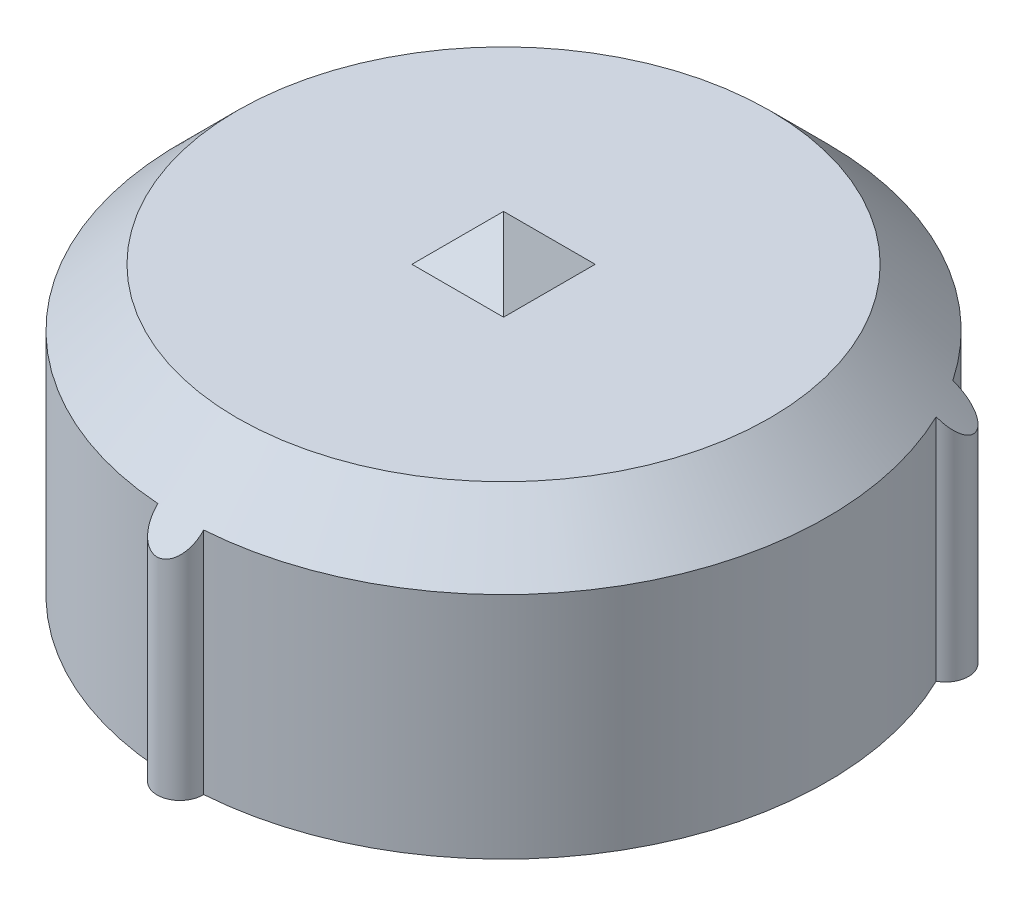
SolidWorks part; units mm, degrees
ref_plane "Front Plane" through (0, 0, 0) normal (0, 0, 1) x (1, 0, 0)
ref_plane "Top Plane" through (0, 0, 0) normal (0, 1, 0) x (1, 0, 0)
ref_plane "Right Plane" through (0, 0, 0) normal (1, 0, 0) x (0, 0, -1)
sketch "Sketch1" plane through (0, 0, 0) normal (0, 0, 1) x (1, 0, 0)
  line L0 (0, 0) -> (0, -66.2626) construction
  line L1 (0, 0) -> (6.05, 0)
  line L2 (6.05, 0) -> (6.05, 5)
  line L4 (6.05, 5) -> (0, 5)
  line L5 (0, 5) -> (0, 0)
  dimension "D1" = 5
  dimension "D2" = 12.1
revolve "Revolve1" add sketch "Sketch1" angle 360 about L0
sketch "Sketch2" plane through (0, 0, 0) normal (0, 1, 0) x (1, 0, 0)
  line L0 (0, 0) -> (0, -5.5148) construction
  line L1 (0, 0) -> (-5.4284, 3.1341) construction
  line L2 (0, 0) -> (5.592, 3.2286) construction
  arc A0 (0.3997, -5.6358) -> (5.0807, 2.4717) centre (0, 0) ccw
  circle A1 centre (0, 0) radius 6.55
  arc A3 (-0.3997, -5.6358) -> (0.3997, -5.6358) centre (0, -5.65) ccw
  arc A4 (-4.6809, 3.1641) -> (-5.0807, 2.4717) centre (-4.893, 2.825) ccw
  arc A5 (-5.0807, 2.4717) -> (-0.3997, -5.6358) centre (0, 0) ccw
  arc A6 (5.0807, 2.4717) -> (4.6809, 3.1641) centre (4.893, 2.825) ccw
  arc A7 (4.6809, 3.1641) -> (-4.6809, 3.1641) centre (0, 0) ccw
  circle A8 centre (0, 0) radius 6.05 construction
  dimension "D1" = 11.3
  dimension "D2" = 0.5
  dimension "D3" = 120
  dimension "D4" = 120
extrude "Extrude1" cut sketch "Sketch2" along normal through all
sketch "Sketch4" plane through (0, 0, 0) normal (0, 1, 0) x (1, 0, 0)
  line L0 (0, 0) -> (4.9919, 0) construction
  line L1 (0, 0) -> (3.8331, -3.8331) construction
  dimension "D1" = 45
ref_plane "Plane1" through (0, 0, 0) normal (0.7071, 0, 0.7071) x (0.7071, 0, -0.7071)
sketch "Sketch6" [suppressed] plane through (0, 0, 0) normal (1, 0, 0) x (0, 0, -1)
  line L0 (0, 0) -> (0, 4.8917) construction
  line L2 (-8.45, 1) -> (-8.45, 5)
  line L3 (-8.45, 5) -> (-4.45, 5)
  line L4 (-4.45, 5) -> (-8.45, 1)
  point P5 (-5.95, 3.5)
  dimension "D1" = 5
  dimension "D2" = 9.3
  dimension "D3" = 45
  dimension "D4" = 1
  dimension "D5" = 1
revolve "Cut-Revolve1" [suppressed] cut sketch "Sketch6" angle 360 about L0
sketch "Sketch5" [suppressed] plane through (0, 0, 0) normal (0, 0, 1) x (1, 0, 0)
  line L0 (1.5, 5) -> (0, 3.5)
  line L2 (0, 3.5) -> (-1.5, 5)
  line L3 (-1.5, 5) -> (1.5, 5)
  line L4 (0, 3.5) -> (0, 5) construction
  line L5 (-0.3998, 5) -> (-6.3, 5) construction
  dimension "D1" = 2
extrude "Extrude2" [suppressed] cut sketch "Sketch5" against normal through all and the other way through all
pattern_linear "LPattern1" [suppressed] count 8 spacing 2 along (1, 0, 0) count 8 spacing 2 along (1, 0, 0)
mirror "Mirror1" [suppressed] about plane through (0, 0, 0) normal (0.7071, 0, 0.7071)
sketch "Sketch7" plane through (0, 0, 0) normal (0, 1, 0) x (1, 0, 0)
  line L1 (-0.8, 0.8) -> (0.8, 0.8)
  line L2 (-0.8, 0.8) -> (-0.8, -0.8)
  line L3 (-0.8, -0.8) -> (0.8, -0.8)
  line L4 (0.8, 0.8) -> (0.8, -0.8)
  line L5 (-0.8, 0.8) -> (0.8, -0.8) construction
  line L6 (-0.8, -0.8) -> (0.8, 0.8) construction
  point P0 (0, 0)
  dimension "D1" = 1.6
extrude "Extrude3" add sketch "Sketch7" along normal blind 5.8
draft "Draft1" type of draft neutral plane draft angle 45 faces to draft 4 parameters "D1"=45
sketch "Sketch8" plane through (0, 0, 0) normal (0, 0, 1) x (1, 0, 0)
  line L0 (0, 0) -> (0, 4.8917) construction
  line L2 (-8.65, 1) -> (-8.65, 5)
  line L3 (-8.65, 5) -> (-4.65, 5)
  line L4 (-4.65, 5) -> (-8.65, 1)
  dimension "D1" = 5
  dimension "D2" = 9.3
  dimension "D3" = 45
  dimension "D4" = 1
revolve "Cut-Revolve3" cut sketch "Sketch8" angle 360 about L0
